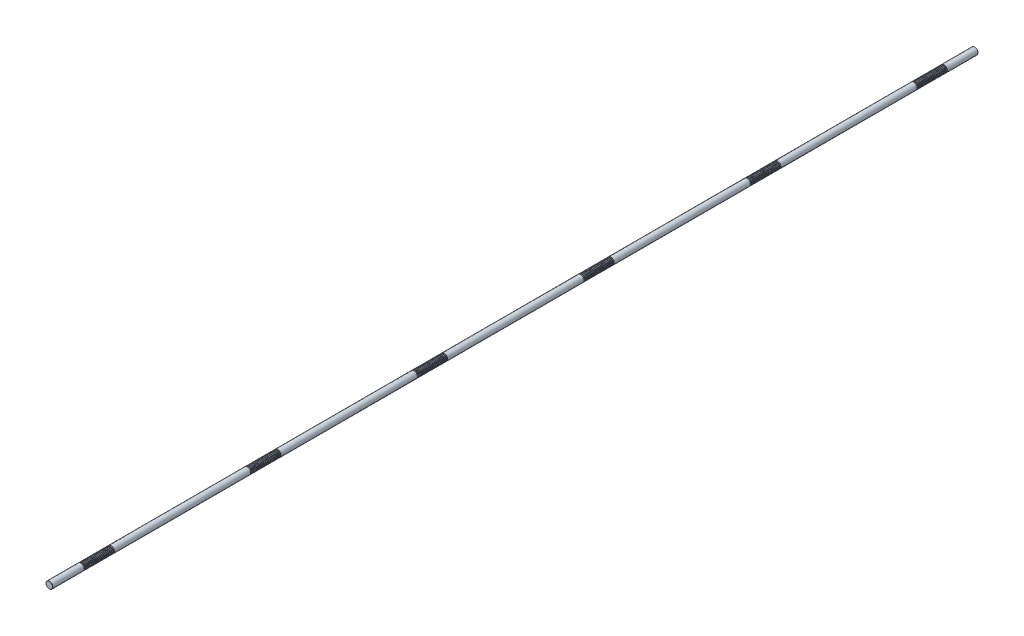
SolidWorks part; units mm, degrees
ref_plane "Front Plane" through (0, 0, 0) normal (0, 0, 1) x (1, 0, 0)
ref_plane "Top Plane" through (0, 0, 0) normal (0, 1, 0) x (1, 0, 0)
ref_plane "Right Plane" through (0, 0, 0) normal (1, 0, 0) x (0, 0, -1)
sketch "Sketch1" plane through (0, 0, 0) normal (0, 0, 1) x (1, 0, 0)
  circle A0 centre (0, 0) radius 11
  dimension "D1" = 22
extrude "Boss-Extrude1" add sketch "Sketch1" along normal mid plane 3000
chamfer "Chamfer1" distance 0.55 angle 45 2 edges at (11, 0, -1500) (11, 0, 1500)
sketch "Sketch2" plane through (0, 0, 0) normal (1, 0, 0) x (0, 0, -1)
  line L0 (1400.3684, 11) -> (1397.1316, 11)
  line L1 (1499.45, 11) -> (-1499.45, 11) construction
  line L2 (1397.1316, 11) -> (1397.8684, 8.25)
  line L3 (1397.8684, 8.25) -> (1399.6316, 8.25)
  line L4 (1399.6316, 8.25) -> (1400.3684, 11)
  line L5 (1500, -10.45) -> (1500, 10.45) construction
  point P4 (1398.75, 11)
  point P7 (1398.75, 8.25)
  point P8 (1400, 9.625)
  point P9 (1397.5, 9.625)
  dimension "D1" = 2.5
  dimension "D2" = 100
  dimension "D3" = 2.75
  dimension "D4" = 30
revolve "Cut-Revolve1" cut sketch "Sketch2" angle 360 about axis through (0, 0, 1500) along (0, 0, -1)
pattern_linear "LPattern1" count 20 spacing 5 along (0, 0, 1) of "Cut-Revolve1"
pattern_linear "LPattern2" count 6 spacing 540 along (0, 0, 1) of "Cut-Revolve1", "LPattern1"
